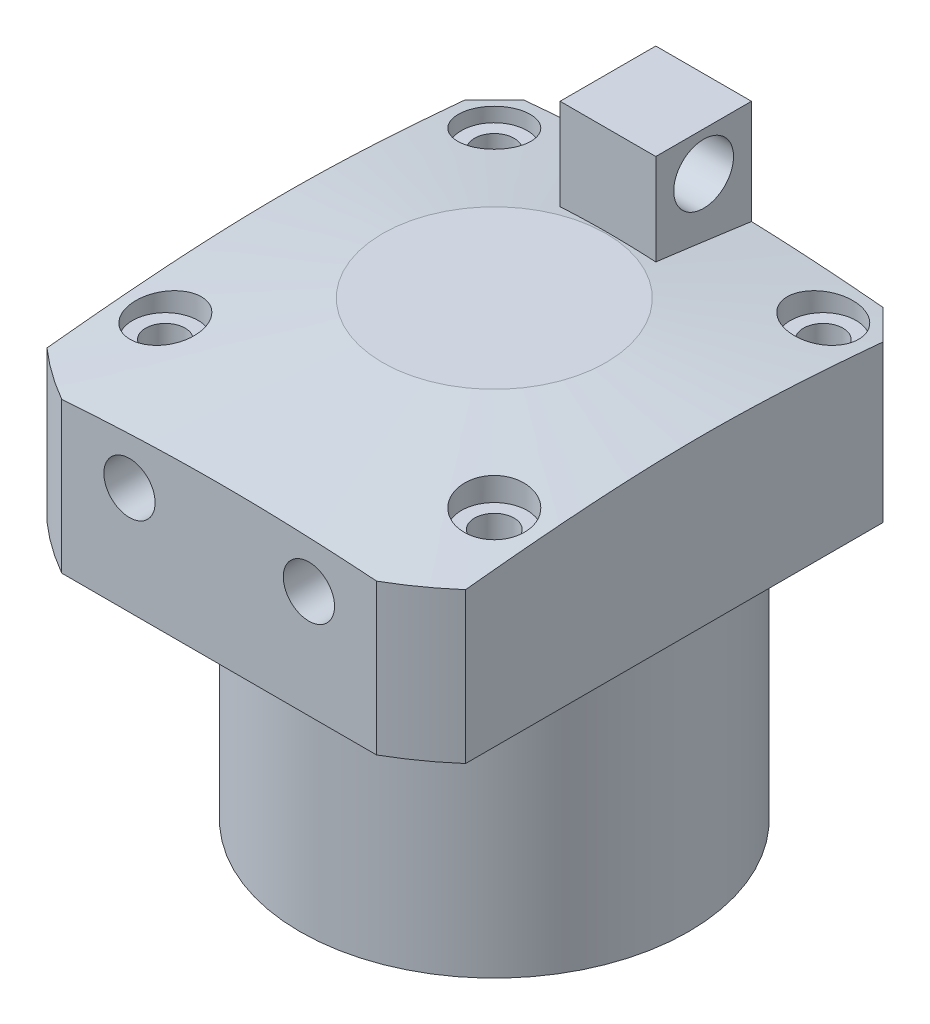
SolidWorks part; units mm, degrees
ref_plane "Front Plane" through (0, 0, 0) normal (0, 0, 1) x (1, 0, 0)
ref_plane "Top Plane" through (0, 0, 0) normal (0, 1, 0) x (1, 0, 0)
ref_plane "Right Plane" through (0, 0, 0) normal (1, 0, 0) x (0, 0, -1)
sketch "Sketch1" plane through (0, 0, 0) normal (0, 0, 1) x (1, 0, 0)
  line L0 (0, 87.0508) -> (0, 0) construction
  line L1 (0, 0) -> (-32.5, 0)
  line L2 (-32.5, 0) -> (-32.5, 45.5)
  line L3 (-32.5, 45.5) -> (-53, 45.5)
  line L4 (-53, 45.5) -> (-53, 70.6778)
  line L5 (-18.688, 75.5) -> (-53, 70.6778)
  line L6 (-18.688, 75.5) -> (0, 75.5)
  line L7 (0, 0) -> (0, 75.5)
  dimension "D1" = 32.5
  dimension "D2" = 45.5
  dimension "D3" = 53
  dimension "D4" = 8
  dimension "D5" = 30
revolve "Revolve1" add sketch "Sketch1" angle 360 about L0
sketch "Sketch2" plane through (0, 75.5, 0) normal (0, 1, 0) x (1, 0, 0)
  line L0 (0, 0) -> (0, 35) construction
  line L1 (-35, 35) -> (35, 35)
  line L2 (-35, 35) -> (-35, -46)
  line L3 (-35, -46) -> (35, -46)
  line L4 (35, 35) -> (35, -46)
  dimension "D1" = 81
  dimension "D2" = 70
  dimension "D3" = 35
extrude "Cut-Extrude2" cut sketch "Sketch2" against normal through all flip side to cut
chamfer "Chamfer1" distance 5 angle 45 2 edges at (35, 58.335, -35) (-35, 58.335, -35)
hole_wizard "G1/8 Tapped Hole1" positions "Sketch6" profile "Sketch5" tap size "G1/8" standard "ISO"
sketch "Sketch6" plane through (0, 0, 46) normal (0, 0, 1) x (1, 0, 0)
  line L0 (-15, 63.5) -> (15, 63.5) construction
  line L4 (0, 63.5) -> (0, 75.5) construction
  line L5 (-26.3249, 75.5) -> (26.3249, 75.5) construction
  point P0 (-15, 63.5)
  point P1 (15, 63.5)
  dimension "D1" = 12
  dimension "D2" = 30
sketch "Sketch5" plane through (-15, 63.5, 46) normal (1, 0, 0) x (0, -1, 0)
  line L0 (0, 0) -> (0, 22.18)
  line L1 (0, 22.18) -> (4.283, 22.18)
  line L2 (4.283, 22.18) -> (4.283, 0)
  line L5 (4.283, 0) -> (0, 0)
  line L10 (0, 22.18) -> (-4.283, 22.18) construction
  line L11 (0, -6.35) -> (0, 107.95) construction
  dimension "Tap Drill Dia." = 8.566
  dimension "Tap Drill Depth" = 22.18
  dimension "Drill Angle" = 180
hole_wizard "CBORE for M6 Hex Socket Head Cap Screw2" positions "Sketch10" profile "Sketch9" counterbore size "M6" standard "ISO"
sketch "Sketch10" plane through (0, 75.5, 0) normal (0, 1, 0) x (-1, 0, 0)
  point P1 (27.5, -27.5)
  point P4 (-27.5, -27.5)
  point P7 (-27.5, 27.5)
  point P10 (27.5, 27.5)
  dimension "D1" = 55
  dimension "D2" = 55
sketch "Sketch9" plane through (-27.5, 75.5, -27.5) normal (1, 0, 0) x (0, 0, 1)
  line L0 (0, 0) -> (0, 30)
  line L1 (3.3, 29.975) -> (3.325, 30)
  line L2 (3.3, 29.975) -> (3.3, 6)
  line L3 (3.3, 6) -> (5.5, 6)
  line L4 (5.5, 6) -> (5.5, 0)
  line L5 (5.5, 0) -> (0, 0)
  line L11 (0, -6.35) -> (0, 107.95) construction
  line L12 (3.325, 30) -> (0, 30)
  line L13 (-3.3, 29.975) -> (-3.325, 30) construction
  dimension "Thru Hole Dia." = 6.6
  dimension "Thru Hole Depth" = 30
  dimension "C'Bore Dia." = 11
  dimension "C'Bore Depth" = 6
  dimension "Far C'Sink Dia." = 6.65
  dimension "Far C'Sink Angle" = 90
hole_wizard "Ø8.0 (8) Diameter Hole2" positions "Sketch12" profile "Sketch11" hole size "Ø8.0" standard "ISO"
sketch "Sketch12" plane through (0, 45.5, 0) normal (0, -1, 0) x (1, 0, 0)
  point P0 (-15, 39.5)
  point P1 (15, 39.5)
  dimension "D1" = 39.5
  dimension "D2" = 15
  dimension "D3" = 15
sketch "Sketch11" plane through (-15, 45.5, 39.5) normal (1, 0, 0) x (0, 0, -1)
  line L0 (0, 0) -> (0, 1.5)
  line L1 (0, 1.5) -> (4, 1.5)
  line L2 (4, 1.5) -> (4, 0)
  line L5 (4, 0) -> (0, 0)
  line L10 (0, 1.5) -> (-4, 1.5) construction
  line L11 (0, -6.35) -> (0, 107.95) construction
  dimension "Hole Dia." = 8
  dimension "Hole Depth" = 1.5
  dimension "Drill Angle" = 180
sketch "Sketch13" plane through (0, 75.5, 0) normal (0, 1, 0) x (-1, 0, 0)
  line L0 (-30, -35) -> (30, -35) construction
  line L1 (8, -19) -> (-8, -19)
  line L2 (8, -19) -> (8, -35)
  line L3 (8, -35) -> (-8, -35)
  line L4 (-8, -19) -> (-8, -35)
  line L5 (8, -19) -> (-8, -35) construction
  line L6 (8, -35) -> (-8, -19) construction
  point P0 (0, -27)
  dimension "D1" = 16
  dimension "D2" = 16
extrude "Boss-Extrude1" add sketch "Sketch13" along normal blind 15 and the other way up to surface separate body
sketch "Sketch14" plane through (8, 0, 0) normal (1, 0, 0) x (0, 0, -1)
  line L0 (19, 90.5) -> (35, 90.5) construction
  line L1 (19, 75.2291) -> (19, 90.5) construction
  circle A0 centre (27, 84) radius 5
  dimension "D1" = 10
  dimension "D2" = 6.5
  dimension "D3" = 8
extrude "Cut-Extrude3" cut sketch "Sketch14" against normal up to surface (16 mm away)
